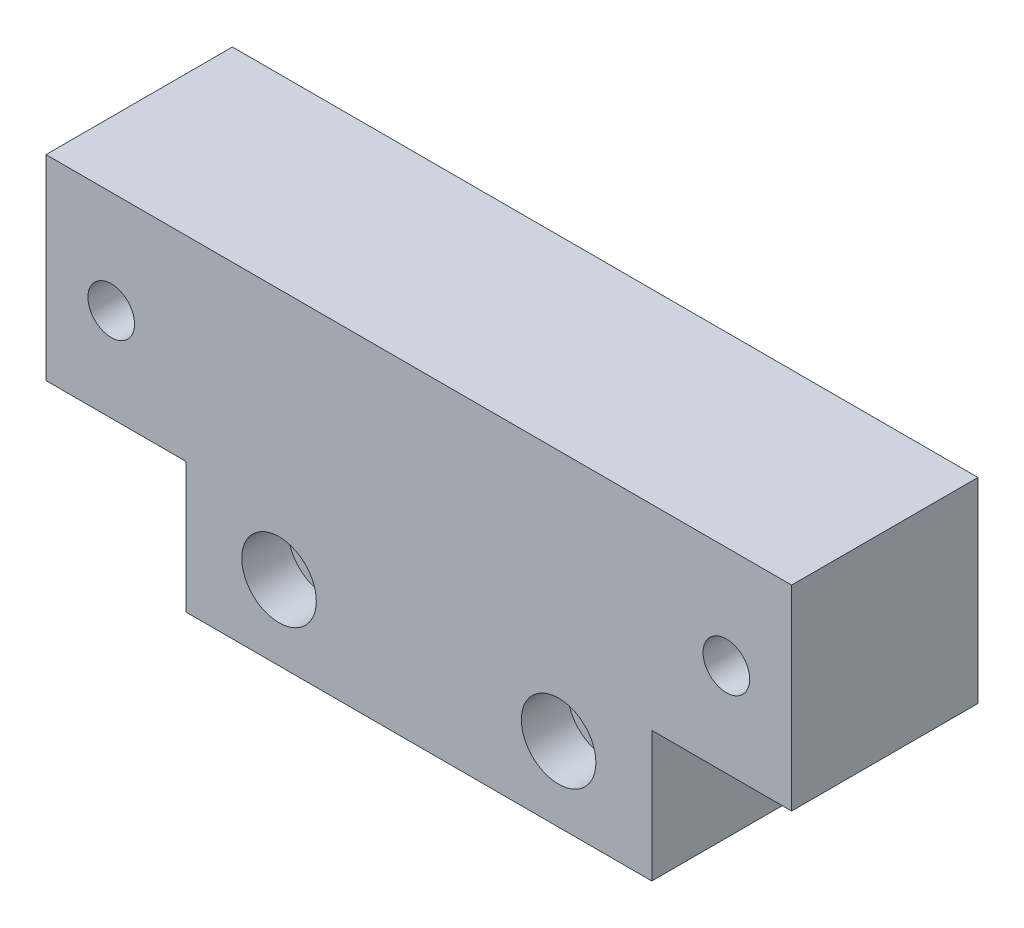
SolidWorks part; units mm, degrees
ref_plane "Alzado" through (0, 0, 0) normal (0, 0, 1) x (1, 0, 0)
ref_plane "Planta" through (0, 0, 0) normal (0, 1, 0) x (1, 0, 0)
ref_plane "Vista lateral" through (0, 0, 0) normal (1, 0, 0) x (0, 0, -1)
sketch "Croquis1" plane through (0, 0, 0) normal (0, 0, 1) x (1, 0, 0)
  line L0 (0, 17.5) -> (0, -17.5) construction
  line L1 (-25, -17.5) -> (25, -17.5)
  line L2 (-40, -3.5) -> (-40, 17.5)
  line L3 (-40, 17.5) -> (40, 17.5)
  line L4 (40, -3.5) -> (40, 17.5)
  line L5 (-40, -17.5) -> (40, 17.5) construction
  line L6 (-40, 17.5) -> (40, -17.5) construction
  line L7 (-40, -3.5) -> (-25, -3.5)
  line L8 (-25, -17.5) -> (-25, -3.5)
  line L9 (25, -17.5) -> (25, -3.5)
  line L11 (25, -3.5) -> (40, -3.5)
  point P0 (0, 0)
  dimension "D1" = 80
  dimension "D2" = 35
  dimension "D3" = 21
  dimension "D4" = 25
extrude "Saliente-Extruir1" add sketch "Croquis1" along normal blind 20
sketch "Croquis2" plane through (0, 0, 20) normal (0, 0, 1) x (1, 0, 0)
  line L0 (0, 17.5) -> (0, -17.5) construction
  line L1 (40, 17.5) -> (-40, 17.5) construction
  line L2 (-25, -17.5) -> (25, -17.5) construction
  line L3 (-25, -3.5) -> (-25, -17.5) construction
  point P6 (-15, -9.5)
  point P9 (15, -9.5)
  dimension "D1" = 10
  dimension "D2" = 8
other "TaladroAvanzado1" parameters "D1"=5, "D2"=8, "D0"=0
sketch "Croquis3" plane through (0, 0, 20) normal (0, 0, 1) x (1, 0, 0)
  circle A0 centre (-15, -9.5) radius 2.5
  circle A1 centre (15, -9.5) radius 2.5
  dimension "D1" = 5
extrude "Cortar-Extruir1" cut sketch "Croquis3" against normal blind 20
sketch "Croquis4" plane through (0, 0, 0) normal (0, 0, -1) x (-1, 0, 0)
  line L0 (0, 17.5) -> (0, -17.5) construction
  line L1 (-40, 17.5) -> (40, 17.5) construction
  line L2 (25, -17.5) -> (-25, -17.5) construction
  line L3 (-25, -3.5) -> (-40, -3.5) construction
  line L4 (-40, -3.5) -> (-40, 17.5) construction
  point P6 (-33, 6.5)
  point P11 (33, 6.5)
  dimension "D1" = 10
  dimension "D2" = 7
other "TaladroAvanzado2" parameters "D1"=11, "D2"=10, "D0"=0
sketch "Croquis5" plane through (0, 0, 0) normal (0, 0, -1) x (-1, 0, 0)
  circle A0 centre (-33, 6.5) radius 2.5
  circle A1 centre (33, 6.5) radius 2.5
  dimension "D1" = 5
extrude "Cortar-Extruir2" cut sketch "Croquis5" against normal blind 20
